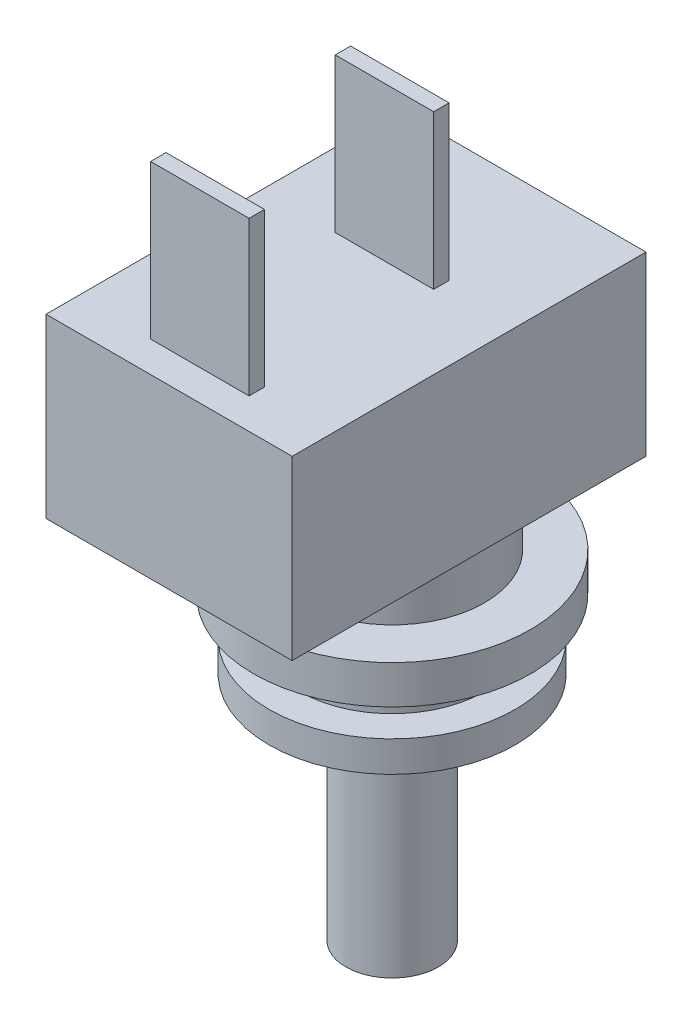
SolidWorks part; units mm, degrees
ref_plane "Спереди" through (0, 0, 0) normal (0, 0, 1) x (1, 0, 0)
ref_plane "Сверху" through (0, 0, 0) normal (0, 1, 0) x (1, 0, 0)
ref_plane "Справа" through (0, 0, 0) normal (1, 0, 0) x (0, 0, -1)
sketch "Эскиз1" plane through (0, 0, 0) normal (0, 1, 0) x (1, 0, 0)
  circle A0 centre (0, 0) radius 8
extrude "Бобышка-Вытянуть1" add sketch "Эскиз1" along normal blind 2
sketch "Эскиз2" plane through (0, 0, 0) normal (0, -1, 0) x (1, 0, 0)
  circle A0 centre (0, 0) radius 6
  circle A1 centre (0, 0) radius 3.5
extrude "Бобышка-Вытянуть2" add sketch "Эскиз2" along normal blind 1
sketch "Эскиз3" plane through (0, 0, 0) normal (0, -1, 0) x (1, 0, 0)
  circle A0 centre (0, 0) radius 3
extrude "Бобышка-Вытянуть3" add sketch "Эскиз3" along normal blind 15
sketch "Эскиз4" plane through (0, 2, 0) normal (0, 1, 0) x (1, 0, 0)
  circle A0 centre (0, 0) radius 6
extrude "Бобышка-Вытянуть4" add sketch "Эскиз4" along normal blind 2.5
sketch "Эскиз5" plane through (0, 4.5, 0) normal (0, 1, 0) x (1, 0, 0)
  circle A0 centre (0, 0) radius 9
extrude "Бобышка-Вытянуть5" add sketch "Эскиз5" along normal blind 2.5
sketch "Эскиз6" plane through (0, 7, 0) normal (0, 1, 0) x (1, 0, 0)
  circle A0 centre (0, 0) radius 6
extrude "Бобышка-Вытянуть6" add sketch "Эскиз6" along normal blind 5
sketch "Эскиз8" plane through (0, 12, 0) normal (0, 1, 0) x (1, 0, 0)
  line L1 (8, 8.5) -> (-8, 8.5)
  line L2 (8, 8.5) -> (8, -14.5)
  line L3 (8, -14.5) -> (-8, -14.5)
  line L4 (-8, 8.5) -> (-8, -14.5)
extrude "Бобышка-Вытянуть7" add sketch "Эскиз8" along normal blind 11.5
sketch "Эскиз9" plane through (0, 23.5, 0) normal (0, 1, 0) x (1, 0, 0)
  line L1 (3.2, 0.5) -> (-3.2, 0.5)
  line L2 (3.2, 0.5) -> (3.2, -0.5)
  line L3 (3.2, -0.5) -> (-3.2, -0.5)
  line L4 (-3.2, 0.5) -> (-3.2, -0.5)
  line L5 (3.2, -12.5) -> (-3.2, -12.5)
  line L6 (3.2, -12.5) -> (3.2, -11.5)
  line L7 (3.2, -11.5) -> (-3.2, -11.5)
  line L8 (-3.2, -12.5) -> (-3.2, -11.5)
extrude "Бобышка-Вытянуть8" add sketch "Эскиз9" along normal blind 10
